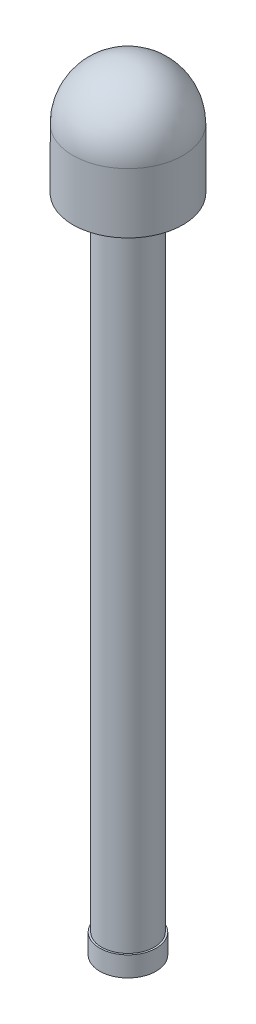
SolidWorks part; units mm, degrees
ref_plane "Front Plane" through (0, 0, 0) normal (0, 0, 1) x (1, 0, 0)
ref_plane "Top Plane" through (0, 0, 0) normal (0, 1, 0) x (1, 0, 0)
ref_plane "Right Plane" through (0, 0, 0) normal (1, 0, 0) x (0, 0, -1)
sketch "Sketch1" plane through (0, 0, 0) normal (0, 0, 1) x (1, 0, 0)
  line L0 (0, 0) -> (0, 183.3967) construction
  line L1 (0, 0) -> (-14.2875, 0)
  line L2 (-14.2875, 0) -> (-14.2875, 10.16)
  line L3 (-14.2875, 10.16) -> (-13.3922, 10.16)
  line L4 (-13.3922, 10.16) -> (-13.3922, 335)
  line L5 (-13.3922, 335) -> (-27.94, 335)
  line L6 (-27.94, 335) -> (-27.94, 365.48)
  line L7 (0, 393.42) -> (0, 0)
  arc A0 (-27.94, 365.48) -> (0, 393.42) centre (0, 365.48) cw
  point P14 (-14.2875, 5.08)
  dimension "D1" = 26.7843
  dimension "D2" = 28.575
  dimension "D3" = 10.16
  dimension "D4" = 55.88
  dimension "D5" = 30.48
  dimension "D6" = 335
revolve "Revolve1" add sketch "Sketch1" angle 360 about L7
sketch "Sketch3" plane through (0, 0, 0) normal (0, 0, 1) x (1, 0, 0)
  line L0 (-27.94, 365.48) -> (-27.94, 335) construction
  line L1 (-27.94, 358.3905) -> (-26.67, 358.3905)
  line L2 (-27.94, 358.3905) -> (-27.94, 345.16)
  line L3 (-27.94, 345.16) -> (-26.67, 345.16)
  line L4 (-26.67, 358.3905) -> (-26.67, 345.16)
  line L5 (-27.94, 335) -> (27.94, 335) construction
  line L6 (0, 335.221) -> (0, 356.0896) construction
  dimension "D1" = 10.16
  dimension "D2" = 1.27
revolve "Cut-Revolve1" cut sketch "Sketch3" angle 27.5 mid plane about L6
fillet "Fillet1" radius 6.604 2 edges at (-26.5225, 358.3905, 6.49) (-26.5225, 358.3905, -6.49)
